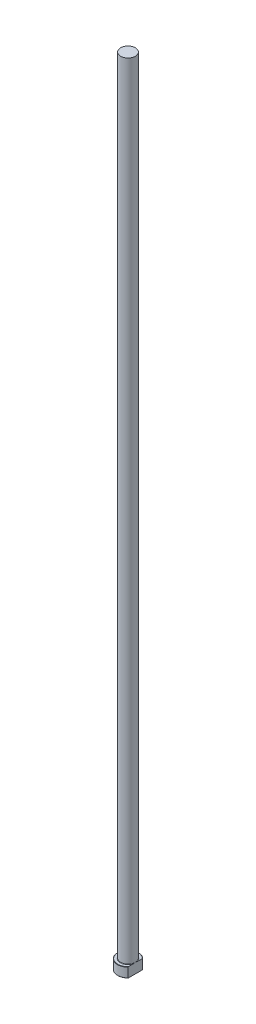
SolidWorks part; units mm, degrees
ref_plane "Front Plane" through (0, 0, 0) normal (0, 0, 1) x (1, 0, 0)
ref_plane "Top Plane" through (0, 0, 0) normal (0, 1, 0) x (1, 0, 0)
ref_plane "Right Plane" through (0, 0, 0) normal (1, 0, 0) x (0, 0, -1)
sketch "Sketch1" plane through (0, 0, 0) normal (0, 0, 1) x (1, 0, 0)
  line L0 (0, 259.9588) -> (0, -15.1925) construction
  line L1 (0, 0) -> (-8.5, 0)
  line L2 (-8.5, 0) -> (-8.5, 8)
  line L3 (-8.5, 8) -> (-6, 8)
  line L4 (-6, 8) -> (-6, 650)
  line L5 (-6, 650) -> (0, 650)
  line L6 (0, 650) -> (0, 0)
  dimension "L" = 650
  dimension "H" = 17
  dimension "T" = 8
  dimension "D" = 12
revolve "Revolve1" add sketch "Sketch1" angle 360 about L0
chamfer "Chamfer1" distance 0.2 angle 45 2 edges at (0, 8, 8.5) (0, 0, 8.5)
fillet "Fillet1" radius 0.3 1 edges at (0, 8, 6)
sketch "Sketch2" plane through (0, 0, 0) normal (0, 1, 0) x (1, 0, 0)
  line L0 (6, -6.0208) -> (6, 6.0208)
  circle A0 centre (0, 0) radius 8.5 construction
  arc A1 (6, -6.0208) -> (6, 6.0208) centre (0, 0) ccw
  circle A2 centre (0, 0) radius 6 construction
extrude "KEYED HEAD" cut sketch "Sketch2" along normal through all
